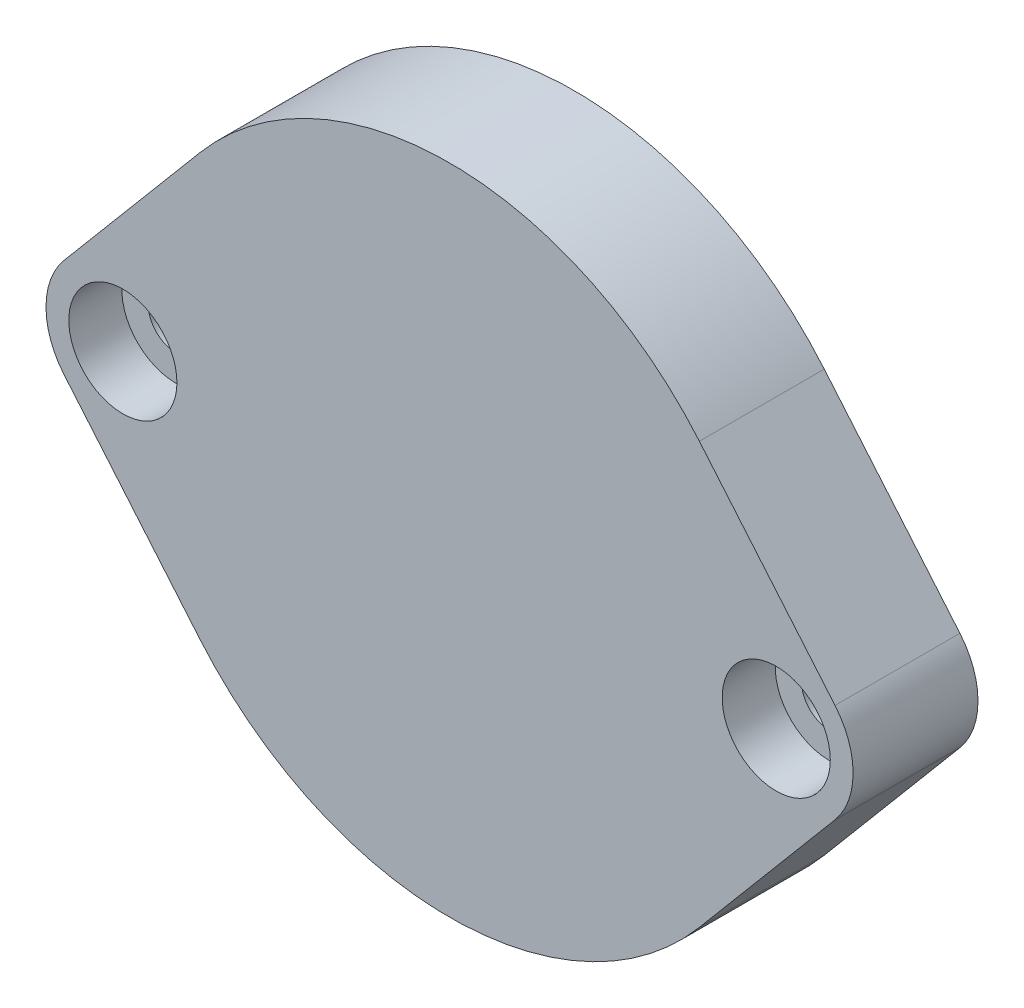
SolidWorks part; units mm, degrees
ref_plane "Front" through (0, 0, 0) normal (0, 0, 1) x (1, 0, 0)
ref_plane "Top" through (0, 0, 0) normal (0, 1, 0) x (1, 0, 0)
ref_plane "Right" through (0, 0, 0) normal (1, 0, 0) x (0, 0, -1)
sketch "Sketch1" plane through (0, 0, 0) normal (0, 0, 1) x (1, 0, 0)
  line L0 (-21.59, 0) -> (0, 0) construction
  line L1 (0, 0) -> (21.59, 0) construction
  line L2 (-16.51, 13.9122) -> (-25.4747, 3.2734)
  line L3 (-25.4747, -3.2734) -> (-16.51, -13.9122)
  line L4 (16.51, -13.9122) -> (25.4747, -3.2734)
  line L5 (25.4747, 3.2734) -> (16.51, 13.9122)
  circle A0 centre (0, 0) radius 21.59
  circle A1 centre (-21.59, 0) radius 5.08
  circle A2 centre (21.59, 0) radius 5.08
  dimension "D1" = 43.18
  dimension "D2" = 10.16
  dimension "D3" = 10.16
  dimension "D4" = 43.18
extrude "Boss-Extrude1" add sketch "Sketch1" along normal blind 8.255 contours A2 A0 A1 | A0 A1 | A0 A2 | A2 A0 | A2 L5 A0 | A0 A1 | A1 A0 L2 | A1 L3 A0 | A2 A0 L4
hole_wizard "CBORE for #6 Socket Head Cap Screw1" positions "Sketch3" profile "Sketch2" counterbore size "#6" standard "ANSI Inch"
sketch "Sketch3" plane through (0, 0, 8.255) normal (0, 0, 1) x (1, 0, 0)
  line L0 (-21.59, 0) -> (0, 0) construction
  line L1 (0, 0) -> (21.59, 0) construction
  point P0 (-21.59, 0)
  point P3 (21.59, 0)
  dimension "D1" = 43.18
sketch "Sketch2" plane through (-21.59, 0, 8.255) normal (1, 0, 0) x (0, -1, 0)
  line L0 (0, 0) -> (0, 8.255)
  line L1 (0, 8.255) -> (1.8288, 8.255)
  line L3 (1.8288, 8.255) -> (1.8288, 3.5052)
  line L4 (1.8288, 3.5052) -> (3.5725, 3.5052)
  line L5 (3.5725, 3.5052) -> (3.5725, 0)
  line L7 (3.5725, 0) -> (0, 0)
  line L11 (0, -6.35) -> (0, 107.95) construction
  dimension "Thru Hole Dia." = 3.6576
  dimension "Thru Hole Depth" = 8.255
  dimension "C'Bore Dia." = 7.145
  dimension "C'Bore Depth" = 3.5052
